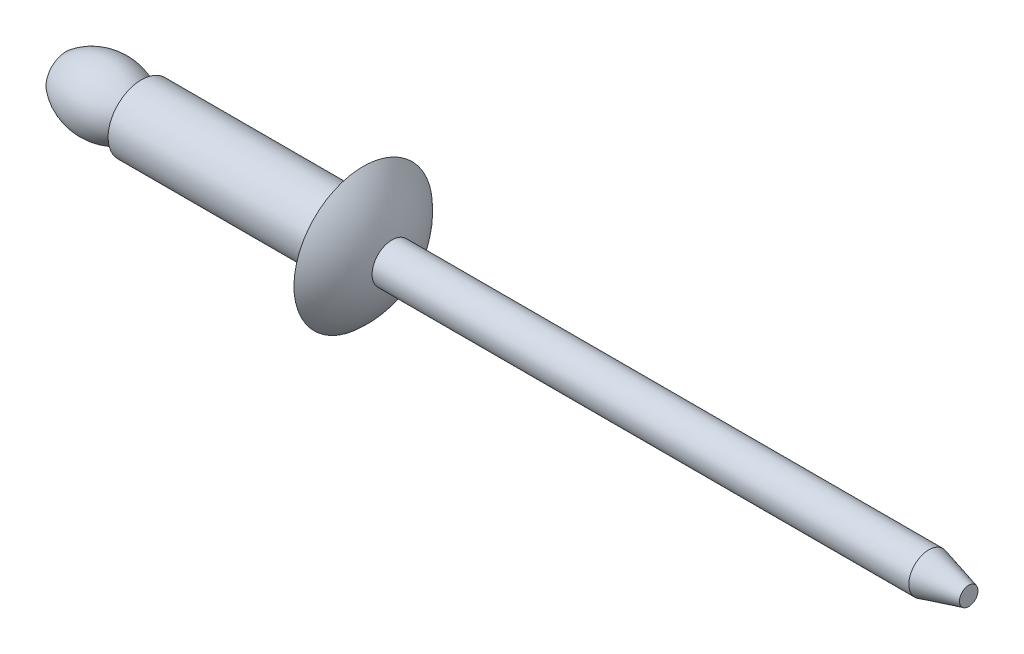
SolidWorks part; units mm, degrees
ref_plane "Front" through (0, 0, 0) normal (0, 0, 1) x (1, 0, 0)
ref_plane "Top" through (0, 0, 0) normal (0, 1, 0) x (1, 0, 0)
ref_plane "Right" through (0, 0, 0) normal (1, 0, 0) x (0, 0, -1)
sketch "Sketch1" plane through (-11.6035, 14.7235, 0) normal (0, 0, 1) x (0, -1, 0)
  line L0 (15.6235, 15.0035) -> (16.2235, 15.0035)
  line L1 (16.2235, 15.0035) -> (16.2235, 25.0035)
  line L2 (16.2235, 25.0035) -> (17.8435, 25.0035)
  line L3 (14.7235, 34.3377) -> (14.7235, -10.975) construction
  line L4 (15.6235, 26.3053) -> (15.6235, 52.3053)
  line L5 (15.6235, 52.3053) -> (14.7235, 52.3053)
  line L6 (14.7235, 11.6035) -> (14.7235, 52.3053)
  line L7 (15.6235, 11.6035) -> (14.7235, 11.6035)
  arc A0 (17.8435, 25.0035) -> (15.6235, 26.3053) centre (14.7235, 22.2269) ccw
  arc A1 (15.6235, 15.0035) -> (15.6235, 11.6035) centre (13.5151, 13.3035) cw
  dimension "l" = 10
  dimension "d" = 3
  dimension "dk" = 6.24
  dimension "d1" = 1.8
  dimension "K" = 1.4
  dimension "l1" = 26
  dimension "l2" = 3.4
revolve "Base-Revolve" add sketch "Sketch1" angle 360 about L3
fillet "Fillet1" radius 0.5 1 edges at (13.4, 1.5, 0)
chamfer "Chamfer1" distance 1.8 angle 15 1 edges at (40.7019, 0.9, 0)
equation "\"D1@Chamfer1\" = \"d1@Sketch1\""
